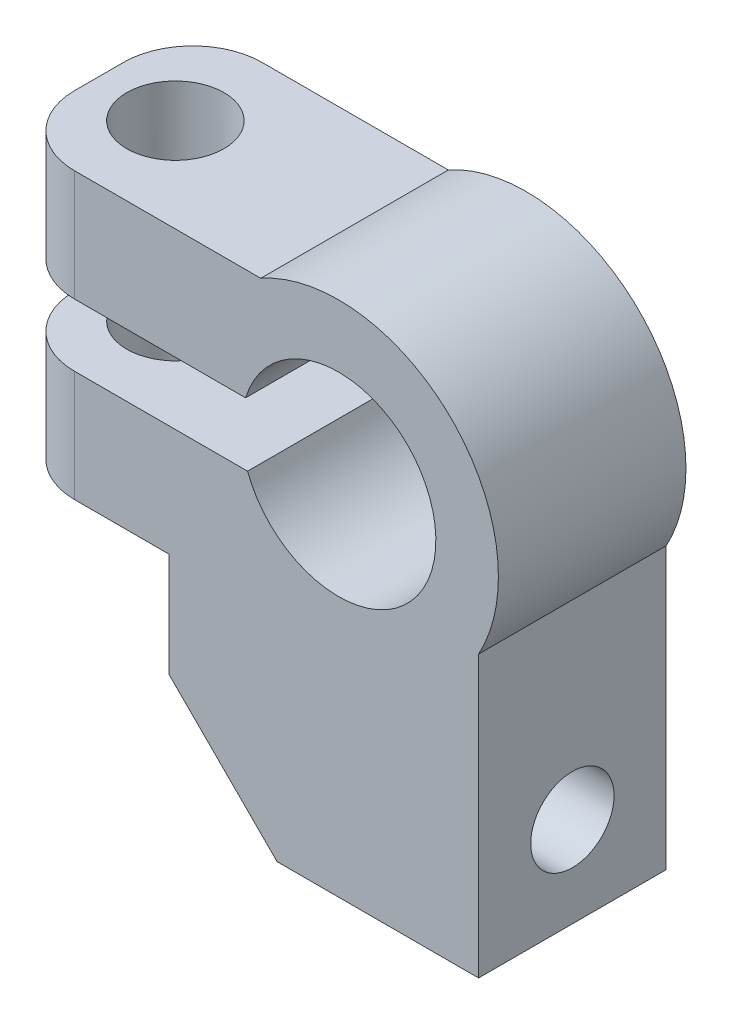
SolidWorks part; units mm, degrees
ref_plane "Face" through (0, 0, 0) normal (0, 0, 1) x (1, 0, 0)
ref_plane "Dessus" through (0, 0, 0) normal (0, 1, 0) x (1, 0, 0)
ref_plane "Droite" through (0, 0, 0) normal (1, 0, 0) x (0, 0, -1)
sketch "Esquisse1" plane through (0, 0, 0) normal (0, 0, 1) x (1, 0, 0)
  line L0 (-11.2075, 20.0846) -> (-48, 20.0846)
  line L1 (-48, 20.0846) -> (-48, 4.0846)
  line L2 (-48, 4.0846) -> (-13.3909, 4.0846)
  line L3 (-13.1087, -4.9154) -> (-48, -4.9154)
  line L4 (-48, -4.9154) -> (-48, -20.9154)
  line L5 (-48, -20.9154) -> (-24.4059, -20.9154)
  line L6 (-24.4059, -20.9154) -> (-24.4059, -35.9154)
  line L7 (-24.4059, -35.9154) -> (-8.8496, -51.4717)
  line L8 (-8.8496, -51.4717) -> (20.1504, -51.4717)
  line L9 (20.1504, -51.4717) -> (20.1504, -11.0887)
  arc A0 (20.1504, -11.0887) -> (-11.2075, 20.0846) centre (0, 0) ccw
  arc A1 (-13.1087, -4.9154) -> (-13.3909, 4.0846) centre (0, 0) ccw
  dimension "D1" = 23
  dimension "D2" = 14
  dimension "D5" = 48
  dimension "D11" = 48
  dimension "D3" = 16
  dimension "D4" = 16
  dimension "D6" = 15
  dimension "D7" = 22
  dimension "D8" = 29
  dimension "D9" = 135
  dimension "D10" = 9
extrude "Base-Extrusion" add sketch "Esquisse1" along normal blind 27
sketch "Esquisse2" plane through (0, -20.9154, 0) normal (0, -1, 0) x (1, 0, 0)
  line L0 (-48, 0) -> (-24.4059, 0) construction
  line L1 (-48, 27) -> (-48, 0) construction
  circle A0 centre (-37, 13.5) radius 7
  dimension "D1" = 13.5
  dimension "D2" = 14
  dimension "D3" = 11
extrude "Enlèv. mat.-Extru.1" cut sketch "Esquisse2" against normal through all
hole_wizard "Dégagement pour M201" positions "Esquisse3D1" profile "Esquisse3" hole size "M20" standard "ISO"
sketch3d "Esquisse3D1"
  line L0 (20.1504, -51.4717, 27) -> (20.1504, -11.0887, 27) construction
  line L1 (20.1504, -51.4717, 27) -> (20.1504, -51.4717, 0) construction
  point P0 (20.1504, -38.4717, 13.5)
  dimension "D1" = 13.5
  dimension "D2" = 13
sketch "Esquisse3" plane through (20.1504, -38.4717, 13.5) normal (0, 1, 0) x (0, 0, -1)
  line L0 (0, 0) -> (0, 33.6052)
  line L1 (0, 33.6052) -> (6, 30)
  line L2 (6, 30) -> (6, 0)
  line L5 (6, 0) -> (0, 0)
  line L10 (0, 33.6052) -> (-6, 30) construction
  line L11 (0, -6.35) -> (0, 107.95) construction
  dimension "Diamètre du perçage" = 12
  dimension "Profondeur du perçage" = 30
  dimension "Angle de pointe" = 118
fillet "Congé1" radius 10
